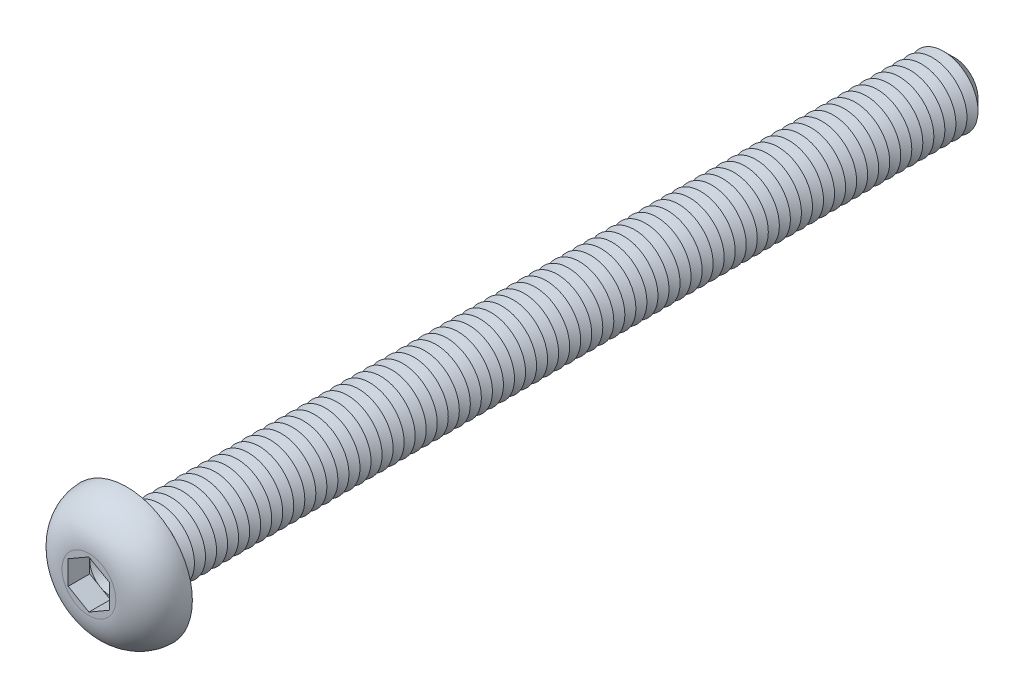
SolidWorks part; units mm, degrees
ref_plane "Front Plane" through (0, 0, 0) normal (0, 0, 1) x (1, 0, 0)
ref_plane "Top Plane" through (0, 0, 0) normal (0, 1, 0) x (1, 0, 0)
ref_plane "Right Plane" through (0, 0, 0) normal (1, 0, 0) x (0, 0, -1)
sketch "Sketch1" plane through (0, 0, 0) normal (1, 0, 0) x (0, 0, -1)
  line L0 (-47.9342, 0) -> (60.3146, 0) construction
sketch "Sketch2" plane through (0, 0, 0) normal (1, 0, 0) x (0, 0, -1)
  line L0 (0, 0) -> (-2.75, 0)
  line L1 (-47.9342, 0) -> (60.3146, 0) construction
  line L2 (-2.75, 0) -> (-2.75, 1.9504)
  line L3 (0, 4.75) -> (0, 0)
  arc A0 (-2.75, 1.9504) -> (0, 4.75) centre (0.05, 1.9504) cw
  dimension "D1" = 2.8
  dimension "D2" = 2.75
  dimension "D3" = 4.75
revolve "Revolve1" add sketch "Sketch2" angle 360 about L0
sketch "Sketch3" plane through (0, 0, 2.75) normal (0, 0, 1) x (1, 0, 0)
  line L1 (0, 1.7321) -> (-1.5, 0.866)
  line L2 (-1.5, 0.866) -> (-1.5, -0.866)
  line L3 (-1.5, -0.866) -> (0, -1.7321)
  line L4 (0, -1.7321) -> (1.5, -0.866)
  line L5 (1.5, -0.866) -> (1.5, 0.866)
  line L6 (1.5, 0.866) -> (0, 1.7321)
  circle A0 centre (0, 0) radius 1.5 construction
  dimension "D1" = 3
extrude "Cut-Extrude1" cut sketch "Sketch3" against normal blind 1.56
sketch "Sketch4" plane through (0, 0, 0) normal (0, 0, -1) x (-1, 0, 0)
  circle A0 centre (0, 0) radius 2.5
  dimension "D1" = 5
extrude "Boss-Extrude1" add sketch "Sketch4" along normal blind 60
chamfer "Chamfer1" distance 0.8 angle 45 1 edges at (-2.5, 0, -60)
sketch "Sketch5" plane through (0, 0, 0) normal (1, 0, 0) x (0, 0, -1)
  line L0 (0.8, 2.5) -> (1.6, 2.5)
  line L1 (59.2, 2.5) -> (0, 2.5) construction
  line L2 (1.6, 2.5) -> (1.2, 1.8072)
  line L3 (1.2, 1.8072) -> (0.8, 2.5)
  line L4 (0, -4.75) -> (0, 4.75) construction
  line L5 (59.2, 2.5) -> (0, 2.5) construction
  dimension "D1" = 0.8
  dimension "D2" = 0.8
revolve "Cut-Revolve1" cut sketch "Sketch5" angle 360 about L0
pattern_linear "LPattern1" count 73 spacing 0.8 along (0, 0, -1) of "Cut-Revolve1"
fillet "Fillet2" radius 0.4 1 edges at (2.5, 0, 0)
sketch "Sketch6" plane through (0, 0, 1.19) normal (0, 0, 1) x (1, 0, 0)
  line L0 (0, -1.7321) -> (1.5, -0.866) construction
  circle A0 centre (0, 0) radius 1.5
extrude "Cut-Extrude2" cut sketch "Sketch6" against normal through all draft 60
